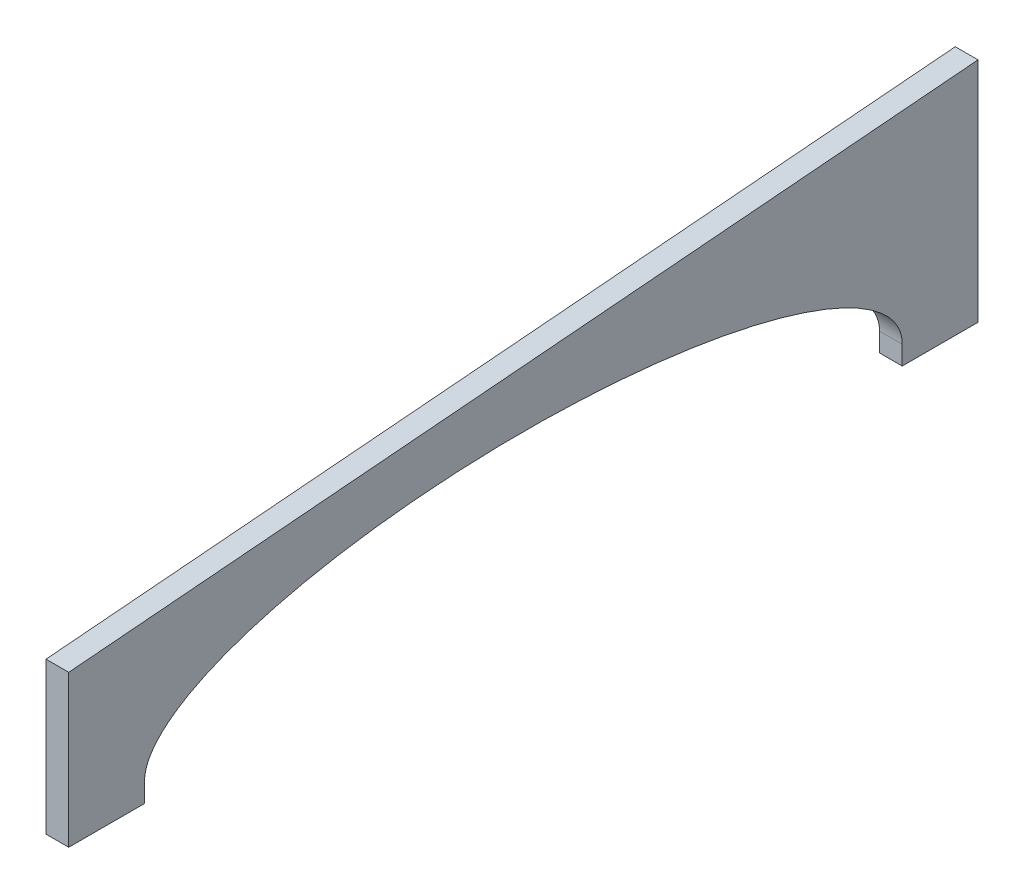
SolidWorks part; units mm, degrees
ref_plane "Plan de face" through (0, 0, 0) normal (0, 0, 1) x (1, 0, 0)
ref_plane "Plan de dessus" through (0, 0, 0) normal (0, 1, 0) x (1, 0, 0)
ref_plane "Plan de droite" through (0, 0, 0) normal (1, 0, 0) x (0, 0, -1)
sketch "Esquisse1" plane through (0, 0, 0) normal (1, 0, 0) x (0, 0, -1)
  line L0 (-37.9643, 0) -> (273.0803, 0) construction
  line L1 (0, -41.6367) -> (0, 112.1868) construction
  line L2 (240, -41.6367) -> (240, 112.1868) construction
  line L3 (273.0803, 60) -> (220, 60) construction
  line L4 (-37.9643, 40) -> (9.2647, 40) construction
  line L5 (0, 40) -> (0, 0)
  line L6 (0, 0) -> (20, 0)
  line L7 (240, 0) -> (240, 60)
  line L8 (0, 40) -> (240, 60) construction
  line L9 (0, 40) -> (240, 60)
  line L10 (220, -18.067) -> (220, 31.967) construction
  line L11 (220, 0) -> (220, 5)
  line L12 (256.9537, 5) -> (11.3134, 5) construction
  line L13 (120, -23.8296) -> (120, 23.0331) construction
  line L14 (20, 0) -> (20, 5)
  line L15 (220, 0) -> (240, 0)
  ellipse E0 centre (120, 5) end of major axis (20, 5) minor radius 30 (220, 5) -> (20, 5) ccw
  dimension "D1" = 240
  dimension "D2" = 40
  dimension "D3" = 60
  dimension "D4" = 20
  dimension "D5" = 5
  dimension "D6" = 120
extrude "Boss.-Extru.1" add sketch "Esquisse1" along normal blind 6
